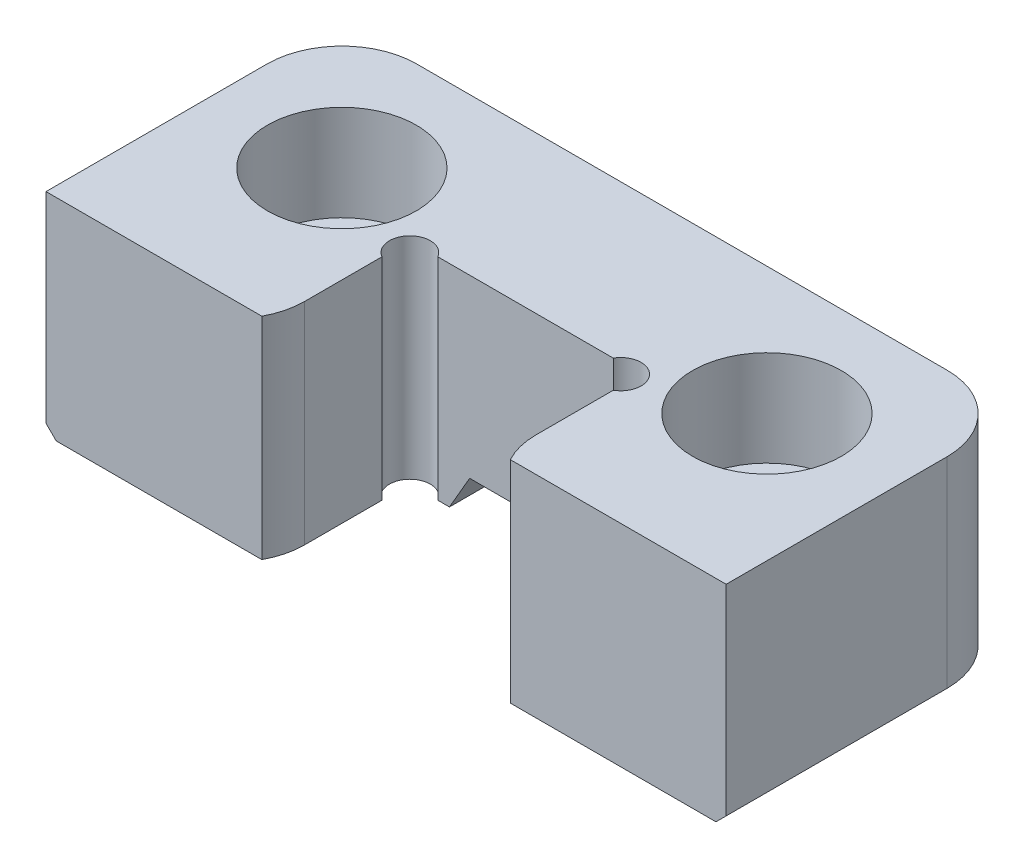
SolidWorks part; units mm, degrees
ref_plane "Front Plane" through (0, 0, 0) normal (0, 0, 1) x (1, 0, 0)
ref_plane "Top Plane" through (0, 0, 0) normal (0, 1, 0) x (1, 0, 0)
ref_plane "Right Plane" through (0, 0, 0) normal (1, 0, 0) x (0, 0, -1)
sketch "Sketch1" plane through (0, 0, 0) normal (0, 1, 0) x (1, 0, 0)
  line L0 (0, 0) -> (0, 50000) construction
  line L1 (0, 0) -> (50000, 0) construction
  line L2 (8.636, 0) -> (25.4, 0)
  line L3 (-25.4, 0) -> (-8.636, 0)
  line L4 (-25.4, 0) -> (-25.4, 22.098)
  line L5 (-25.4, 22.098) -> (25.4, 22.098)
  line L6 (25.4, 0) -> (25.4, 22.098)
  line L8 (-8.636, 0) -> (-8.636, 10.414)
  line L9 (-8.636, 10.414) -> (8.636, 10.414)
  line L10 (8.636, 0) -> (8.636, 10.414)
  dimension "D1" = 22.098
  dimension "D2" = 50.8
  dimension "D3" = 17.272
  dimension "D4" = 10.414
extrude "Boss-Extrude1" add sketch "Sketch1" against normal blind 15.748 separate body
fillet "Fillet1" radius 5.588 2 edges at (25.4, -7.874, -22.098) (-25.4, -7.874, -22.098)
sketch "Sketch2" plane through (0, 0, 0) normal (0, 1, 0) x (1, 0, 0)
  line L0 (0, 0) -> (0, 50000) construction
  line L1 (-8.636, 0) -> (-8.636, 10.414) construction
  line L2 (-25.4, 0) -> (-8.636, 0) construction
  line L3 (-8.636, 2.54) -> (-8.636, 3.4579)
  line L4 (-28.575, 0) -> (-9.2819, 0)
  line L5 (28.575, 0) -> (28.575, -12.7)
  line L6 (-28.575, -12.7) -> (28.575, -12.7)
  line L7 (-8.636, 3.4579) -> (8.636, 3.4579)
  line L8 (-28.575, 0) -> (-28.575, -12.7)
  line L9 (28.575, 0) -> (9.2819, 0)
  line L10 (8.636, 2.54) -> (8.636, 3.4579)
  arc A4 (9.2819, 0) -> (8.636, 2.54) centre (13.9529, 2.54) cw
  arc A5 (-9.2819, 0) -> (-8.636, 2.54) centre (-13.9529, 2.54) ccw
  point P14 (0, -12.7)
  point P24 (0, 3.4579)
  dimension "D1" = 2.54
  dimension "D5" = 12.7
extrude "Cut-Extrude1" cut sketch "Sketch2" against normal through all
sketch "Sketch3" plane through (0, 0, 0) normal (0, 1, 0) x (1, 0, 0)
  line L1 (-8.636, 10.414) -> (8.636, 10.414) construction
  line L2 (-9.398, 2.54) -> (-9.398, 10.414)
  line L3 (-9.398, 2.54) -> (-9.398, 10.414) construction
  line L4 (0, 0) -> (0, 50000) construction
  line L6 (-6.35, 11.176) -> (6.35, 11.176) construction
  circle A0 centre (-7.874, 9.652) radius 1.524
  circle A1 centre (7.874, 9.652) radius 1.524
  dimension "D3" = 1.524
  dimension "D2" = 0.762
  dimension "D1" = 0.762
extrude "Cut-Extrude2" cut sketch "Sketch3" against normal through all
sketch "Sketch5" plane through (0, 0, -22.098) normal (0, 0, -1) x (-1, 0, 0)
  line L0 (-4.7625, -14.1605) -> (4.7625, -14.1605)
  line L1 (-19.812, 0) -> (19.812, 0) construction
  line L2 (0, 0) -> (0, 50000) construction
  line L3 (4.7625, -14.1605) -> (5.679, -15.748)
  line L4 (-19.812, -15.748) -> (19.812, -15.748) construction
  line L5 (-5.679, -15.748) -> (5.679, -15.748)
  line L6 (-4.7625, -14.1605) -> (-5.679, -15.748)
  point P4 (0, 0)
  point P12 (0, -15.748)
  point P13 (0, -14.1605)
  dimension "D1" = 30
  dimension "D2" = 1.5875
  dimension "D3" = 9.525
extrude "Cut-Extrude3" cut sketch "Sketch5" against normal through all
chamfer "Chamfer1" distance 0.762 angle 45 6 edges at (12.7455, -15.748, -22.098) (23.7633, -15.748, -20.4613) (25.4, -15.748, -8.255) (-12.7455, -15.748, -22.098) (-23.7633, -15.748, -20.4613) (-25.4, -15.748, -8.255)
chamfer "Chamfer5" distance 3.81 angle 15 1 edges at (0, -14.1605, -10.414)
hole_wizard "1/4\" CBORE" positions "Sketch7" profile "Sketch6" counterbore size "1/4" standard "Ansi Inch"
sketch "Sketch7" plane through (9.0831, 0, -5.226) normal (0, 1, 0) x (-1, 0, 0)
  line L0 (9.0831, 0) -> (9.0831, 50000) construction
  line L1 (-10.7289, -16.872) -> (28.8951, -16.872) construction
  line L2 (34.4831, -11.284) -> (34.4831, 5.226) construction
  point P0 (24.9581, -7.347)
  point P11 (-6.7919, -7.347)
  dimension "D1" = 9.525
  dimension "D2" = 9.525
sketch "Sketch6" plane through (-15.875, 0, -12.573) normal (1, 0, 0) x (0, 0, 1)
  line L0 (0, 0) -> (0, 15.748)
  line L1 (0, 15.748) -> (3.2639, 15.748)
  line L3 (3.2639, 15.748) -> (3.2639, 7.1437)
  line L4 (3.2639, 7.1437) -> (5.5562, 7.1437)
  line L5 (5.5562, 7.1437) -> (5.5562, 0)
  line L7 (5.5562, 0) -> (0, 0)
  line L11 (0, -6.35) -> (0, 107.95) construction
  dimension "Thru Hole Dia." = 6.5278
  dimension "Thru Hole Depth" = 15.748
  dimension "C'Bore Dia." = 11.1125
  dimension "C'Bore Depth" = 7.1437
